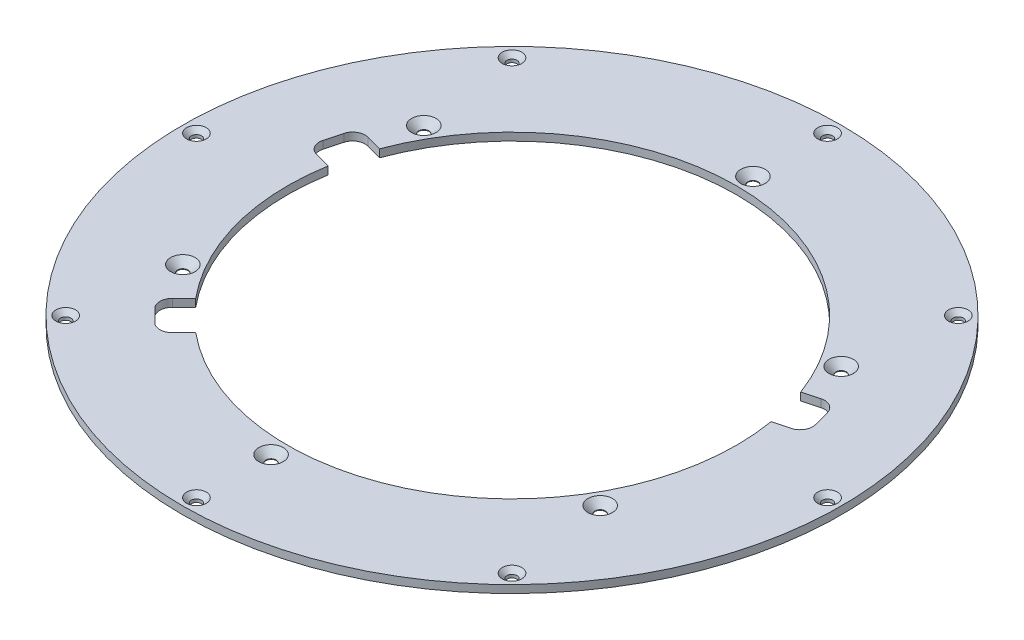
SolidWorks part; units mm, degrees
ref_plane "Front" through (0, 0, 0) normal (0, 0, 1) x (1, 0, 0)
ref_plane "Top" through (0, 0, 0) normal (0, 1, 0) x (1, 0, 0)
ref_plane "Right" through (0, 0, 0) normal (1, 0, 0) x (0, 0, -1)
sketch "Sketch1" plane through (0, 0, 0) normal (0, 1, 0) x (1, 0, 0)
  circle A0 centre (0, 0) radius 134.62
  circle A1 centre (0, 0) radius 91.7575
  dimension "D1" = 269.24
  dimension "D2" = 183.515
extrude "Boss-Extrude1" add sketch "Sketch1" along normal blind 3.175
hole_wizard "CSK for M4 Flat Head Machine Screw1" positions "Sketch2" profile "Sketch3" countersink size "M4" standard "ANSI Metric"
sketch "Sketch2" plane through (0, 3.175, 0) normal (0, 1, 0) x (1, 0, 0)
  point P0 (0, 128.905)
  dimension "D1" = 128.905
sketch "Sketch3" plane through (0, 3.175, -128.905) normal (1, 0, 0) x (0, 0, 1)
  line L0 (0, 0) -> (0, 3.175)
  line L1 (0, 3.175) -> (2.0828, 3.175)
  line L2 (2.0828, 3.175) -> (2.0828, 1.9177)
  line L3 (2.0828, 1.9177) -> (4.0005, 0)
  line L5 (4.0005, 0) -> (0, 0)
  line L6 (-2.0828, 1.9177) -> (-4.0005, 0) construction
  line L11 (0, -6.35) -> (0, 107.95) construction
  dimension "Thru Hole Dia." = 4.1656
  dimension "Thru Hole Depth" = 3.175
  dimension "Near C'Sink Dia." = 8.001
  dimension "Near C'Sink Angle" = 90
pattern_circular "CirPattern1" count 8 over 360 about axis through (0, 0, 0) along (0, 1, 0) of "CSK for M4 Flat Head Machine Screw1"
hole_wizard "CSK for M4 Flat Head Machine Screw2" positions "Sketch5" profile "Sketch6" countersink size "M4" standard "ANSI Metric"
sketch "Sketch5" plane through (0, 3.175, 0) normal (0, 1, 0) x (1, 0, 0)
  point P0 (0, 98.425)
  dimension "D1" = 98.425
sketch "Sketch6" plane through (0, 3.175, -98.425) normal (1, 0, 0) x (0, 0, 1)
  line L0 (0, 0) -> (0, 3.175)
  line L1 (0, 3.175) -> (2.0828, 3.175)
  line L2 (2.0828, 3.175) -> (2.0828, 2.921)
  line L3 (2.0828, 2.921) -> (5.0038, 0)
  line L5 (5.0038, 0) -> (0, 0)
  line L6 (-2.0828, 2.921) -> (-5.0038, 0) construction
  line L11 (0, -6.35) -> (0, 107.95) construction
  dimension "Thru Hole Dia." = 4.1656
  dimension "Thru Hole Depth" = 3.175
  dimension "Near C'Sink Dia." = 10.0076
  dimension "Near C'Sink Angle" = 90
pattern_circular "CirPattern3" count 6 over 360 about axis through (0, 0, 0) along (0, 1, 0) of "CSK for M4 Flat Head Machine Screw2"
sketch "Sketch7" plane through (0, 3.175, 0) normal (0, 1, 0) x (1, 0, 0)
  line L0 (0, 0) -> (134.62, 0) construction
  line L1 (-2.2187, 8.2804) -> (92.5458, 33.6725)
  line L2 (-2.2187, 8.2804) -> (2.2187, -8.2804)
  line L3 (2.2187, -8.2804) -> (96.9833, 17.1117)
  line L4 (98.7675, 30.0804) -> (100.5754, 23.3334)
  arc A0 (96.9833, 17.1117) -> (100.5754, 23.3334) centre (95.6685, 22.0186) ccw
  arc A1 (92.5458, 33.6725) -> (98.7675, 30.0804) centre (93.8606, 28.7656) cw
  circle A2 centre (0, 0) radius 134.62 construction
  point P4 (0, 0)
  point P8 (101.8902, 18.4265)
  point P11 (97.4527, 34.9873)
  dimension "D3" = 5.08
  dimension "D1" = 103.1875
  dimension "D2" = 17.145
  dimension "D4" = 15
extrude "Cut-Extrude2" cut sketch "Sketch7" against normal through all
pattern_circular "CirPattern4" count 12 over 360 about axis through (0, 3.175, 0) along (0, 1, 0) of "Cut-Extrude2"
